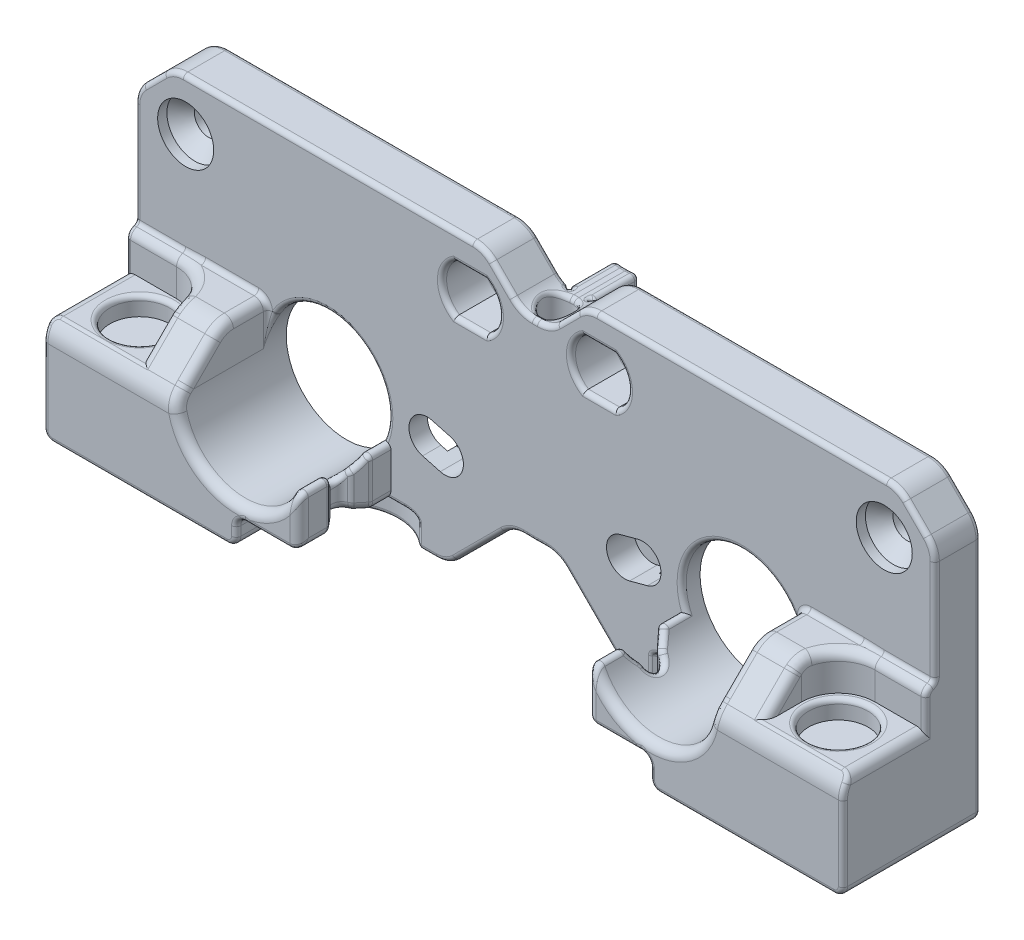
SolidWorks part; units mm, degrees
ref_plane "Front" through (0, 0, 0) normal (0, 0, 1) x (1, 0, 0)
ref_plane "Top" through (0, 0, 0) normal (0, 1, 0) x (1, 0, 0)
ref_plane "Right" through (0, 0, 0) normal (1, 0, 0) x (0, 0, -1)
sketch "Sketch1" plane through (0, 0, 0) normal (0, 0, 1) x (1, 0, 0)
  line L0 (-38.02, 0) -> (38.02, 0) construction
  line L1 (38.02, 0) -> (38.02, -31) construction
  line L2 (38.02, -31) -> (-38.02, -31) construction
  line L3 (-38.02, -31) -> (-38.02, 0) construction
  line L4 (-8.7082, -2.6) -> (-5.3318, -2.6)
  line L5 (-7.02, 0) -> (-7.02, -31) construction
  line L6 (7.02, 0) -> (7.02, -31) construction
  line L7 (0, 0) -> (0, -31) construction
  line L8 (-43.52, 5.5) -> (43.52, 5.5)
  line L9 (-43.52, 5.5) -> (-43.52, -36.5)
  line L10 (-43.52, -36.5) -> (43.52, -36.5)
  line L11 (43.52, 5.5) -> (43.52, -36.5)
  line L12 (-8.7082, 2.6) -> (-5.3318, 2.6)
  line L13 (-38.02, 2.6) -> (38.02, 2.6) construction
  line L14 (-38.02, -2.6) -> (38.02, -2.6) construction
  line L15 (5.3318, -2.6) -> (8.7082, -2.6)
  line L16 (5.3318, 2.6) -> (8.7082, 2.6)
  line L17 (-38.02, 0) -> (-7.02, -31) construction
  line L18 (7.02, -31) -> (38.02, 0) construction
  circle A0 centre (-38.02, 0) radius 1.55
  arc A1 (-5.3318, -2.6) -> (-5.3318, 2.6) centre (-7.02, 0) ccw
  arc A2 (5.3318, 2.6) -> (5.3318, -2.6) centre (7.02, 0) ccw
  circle A3 centre (38.02, 0) radius 1.55
  circle A4 centre (38.02, -31) radius 1.55
  circle A5 centre (7.02, -31) radius 1.55
  circle A6 centre (-7.02, -31) radius 1.55
  circle A7 centre (-38.02, -31) radius 1.55
  arc A8 (8.7082, -2.6) -> (8.7082, 2.6) centre (7.02, 0) ccw
  arc A9 (-8.7082, 2.6) -> (-8.7082, -2.6) centre (-7.02, 0) ccw
  circle A10 centre (-22.52, -15.5) radius 6.55
  circle A11 centre (22.52, -15.5) radius 6.55
  dimension "D5" = 3.1
  dimension "D10" = 6.2
  dimension "D13" = 13.1
  dimension "D1" = 31
  dimension "D2" = 31
  dimension "D3" = 31
  dimension "D4" = 14.04
  dimension "D6" = 5.5
  dimension "D7" = 5.5
  dimension "D8" = 5.5
  dimension "D9" = 5.5
  dimension "D11" = 2.6
  dimension "D12" = 2.6
extrude "Boss-Extrude1" add sketch "Sketch1" along normal blind 15
sketch "Sketch2" plane through (0, 0, 0) normal (0, 0, 1) x (1, 0, 0)
  line L0 (-43.52, 5.5) -> (-43.52, -36.5) construction
  line L1 (-22.52, -23.4) -> (22.52, -23.4)
  line L2 (-53.52, -26.4) -> (-53.52, -46.5)
  line L3 (-53.52, -46.5) -> (53.52, -46.5)
  line L4 (53.52, -26.4) -> (53.52, -46.5)
  line L5 (-43.52, -36.5) -> (43.52, -36.5) construction
  line L6 (43.52, -36.5) -> (43.52, 5.5) construction
  line L7 (-22.52, -23.4) -> (-22.52, -26.4)
  line L8 (22.52, -23.4) -> (22.52, -26.4)
  line L9 (53.52, -26.4) -> (22.52, -26.4)
  line L10 (-22.52, -26.4) -> (-53.52, -26.4)
  circle A0 centre (-38.02, 0) radius 1.55 construction
  dimension "D1" = 23.4
  dimension "D2" = 10
  dimension "D3" = 10
  dimension "D4" = 10
  dimension "D5" = 21
  dimension "D6" = 21
  dimension "D7" = 3
extrude "Cut-Extrude2" cut sketch "Sketch2" along normal through all
sketch "Sketch14" plane through (0, -23.4, 0) normal (0, -1, 0) x (1, 0, 0)
  line L0 (22.52, 15) -> (22.52, 0) construction
  line L1 (-22.52, 0) -> (22.52, 0)
  line L2 (-22.52, 0) -> (-22.52, 5)
  line L3 (-22.52, 5) -> (22.52, 5)
  line L4 (22.52, 0) -> (22.52, 5)
  dimension "D1" = 5
extrude "Boss-Extrude4" add sketch "Sketch14" along normal up to surface (3 mm away)
sketch "Sketch3" plane through (0, 0, 15) normal (0, 0, 1) x (1, 0, 0)
  line L0 (43.52, -26.4) -> (43.52, 5.5) construction
  line L1 (-43.52, 5.5) -> (43.52, 5.5)
  line L2 (-43.52, 5.5) -> (-43.52, -11)
  line L3 (-43.52, -11) -> (43.52, -11)
  line L4 (43.52, 5.5) -> (43.52, -11)
  dimension "D1" = 16.5
extrude "Cut-Extrude3" cut sketch "Sketch3" against normal offset from surface (10 mm away) 5
sketch "Sketch5" plane through (0, 0, 5) normal (0, 0, 1) x (1, 0, 0)
  line L0 (-6.52, 6.5) -> (-1.52, 1.5)
  line L1 (1.52, 1.5) -> (6.52, 6.5)
  line L2 (0, 1.5) -> (0, 0) construction
  line L3 (-6.52, 6.5) -> (6.52, 6.5)
  line L4 (-43.52, 5.5) -> (43.52, 5.5) construction
  line L5 (-1.52, 1.5) -> (1.52, 1.5)
  dimension "D1" = 45
  dimension "D2" = 4
  dimension "D3" = 5
  dimension "D4" = 3.04
extrude "Cut-Extrude4" cut sketch "Sketch5" against normal through all and the other way through all
sketch "Sketch8" plane through (0, 0, 5) normal (0, 0, 1) x (1, 0, 0)
  line L0 (22.52, -23.4) -> (-22.52, -23.4) construction
  line L1 (-17.7605, -11) -> (17.7605, -11) construction
  line L2 (15.67, -23.4) -> (-15.67, -23.4)
  line L3 (-29.07, -11) -> (-27.2795, -11)
  line L5 (29.07, -15.5) -> (29.07, -11)
  line L6 (27.2795, -11) -> (29.07, -11)
  line L8 (-17.7605, -11) -> (17.7605, -11)
  line L9 (-29.07, -15.5) -> (-29.07, -11)
  line L10 (-15.97, -15.5) -> (-15.67, -15.5)
  line L11 (-15.67, -15.5) -> (-15.67, -23.4)
  line L12 (15.97, -15.5) -> (15.67, -15.5)
  line L13 (15.67, -15.5) -> (15.67, -23.4)
  arc A0 (-27.2795, -11) -> (-17.7605, -11) centre (-22.52, -15.5) ccw construction
  arc A1 (17.7605, -11) -> (27.2795, -11) centre (22.52, -15.5) ccw construction
  arc A2 (-15.97, -15.5) -> (-17.7605, -11) centre (-22.52, -15.5) ccw
  arc A3 (29.07, -15.5) -> (27.2795, -11) centre (22.52, -15.5) ccw
  arc A4 (17.7605, -11) -> (15.97, -15.5) centre (22.52, -15.5) ccw
  arc A5 (-27.2795, -11) -> (-29.07, -15.5) centre (-22.52, -15.5) ccw
  dimension "D1" = 0.3
  dimension "D2" = 0.3
extrude "Cut-Extrude7" cut sketch "Sketch8" along normal through all
chamfer "Chamfer1" distance 4 angle 45 2 edges at (43.52, 5.5, 2.5) (-43.52, 5.5, 2.5)
sketch "Sketch4" plane through (0, 0, 0) normal (0, 0, 1) x (1, 0, 0)
  line L0 (0, 0) -> (0, -23.4) construction
  line L1 (43.52, -23.4) -> (-43.52, -23.4) construction
  line L2 (-1.52, 1.5) -> (1.52, 1.5) construction
  line L3 (1.35, -26.4) -> (-1.35, -26.4)
  line L4 (1.35, -26.4) -> (1.35, 1.5)
  line L5 (1.35, 1.5) -> (-1.35, 1.5)
  line L6 (-1.35, -26.4) -> (-1.35, 1.5)
  line L7 (43.52, -26.4) -> (-43.52, -26.4) construction
  dimension "D1" = 2.7
extrude "Boss-Extrude2" add sketch "Sketch4" against normal blind 5
sketch "Sketch6" plane through (0, -11, 0) normal (0, 1, 0) x (1, 0, 0)
  line L5 (38.02, -5) -> (38.02, -15) construction
  line L6 (43.52, -5) -> (29.07, -5) construction
  line L8 (29.07, -15) -> (43.52, -15) construction
  line L11 (34.02, -10) -> (34.02, -17)
  line L12 (38.02, -6) -> (45.52, -6)
  line L13 (34.02, -17) -> (45.52, -17)
  line L14 (45.52, -17) -> (45.52, -6)
  line L15 (43.52, -5) -> (43.52, -15) construction
  arc A0 (38.02, -6) -> (34.02, -10) centre (38.02, -10) ccw
  dimension "D1" = 8
  dimension "D3" = 2
  dimension "D4" = 31
  dimension "D2" = 2
extrude "Cut-Extrude5" cut sketch "Sketch6" against normal blind 4
sketch "Sketch9" plane through (0, 0, 0) normal (0, 1, 0) x (1, 0, 0)
  line L2 (15.97, -15) -> (29.07, -15) construction
  line L3 (15, -8.4) -> (11, -8.4)
  line L4 (15, -8.4) -> (16.5, -8.4)
  line L5 (15, -10.6) -> (11, -10.6)
  line L6 (11, -8.4) -> (11, -10.6)
  line L7 (15, -8.4) -> (11, -10.6) construction
  line L8 (15, -10.6) -> (11, -8.4) construction
  line L9 (16.5, -10.6) -> (15, -10.6)
  line L10 (13, -9.5) -> (16.5, -9.5) construction
  arc A0 (16.5, -10.6) -> (16.5, -8.4) centre (16.5, -9.5) ccw
  point P0 (13, -9.5)
  point P12 (0, 0)
  dimension "D2" = 2.2
  dimension "D5" = 2.2
  dimension "D1" = 5.5
  dimension "D3" = 1.5
  dimension "D4" = 4
  dimension "D6" = 16.5
extrude "Cut-Extrude8" cut sketch "Sketch9" against normal through all
sketch "Sketch13" plane through (0, -15, 0) normal (0, 1, 0) x (1, 0, 0)
  circle A0 centre (38.02, -10) radius 3.25
  dimension "D1" = 6.5
extrude "Cut-Extrude12" cut sketch "Sketch13" against normal blind 2
sketch "Sketch15" plane through (0, -26.4, 0) normal (0, -1, 0) x (1, 0, 0)
  line L0 (43.52, 0) -> (1.35, 0) construction
  arc A0 (16.5, 8.4) -> (16.5, 10.6) centre (16.5, 9.5) ccw construction
  circle A1 centre (16.5, 9.5) radius 6
  dimension "D1" = 3.5
extrude "Cut-Extrude13" cut sketch "Sketch15" against normal up to surface (3 mm away)
sketch "Sketch16" plane through (0, 0, 0) normal (0, 0, -1) x (-1, 0, 0)
  circle A0 centre (-22.52, -15.5) radius 11.2
  dimension "D1" = 22.4
extrude "Cut-Extrude14" cut sketch "Sketch16" against normal blind 3
sketch "Sketch19" plane through (0, 0, 5) normal (0, 0, 1) x (1, 0, 0)
  line L0 (-22.52, -15.5) -> (22.52, -15.5) construction
  line L1 (9.7881, -16.0176) -> (11.72, -15.5) construction
  line L2 (9.2705, -14.0858) -> (11.2024, -13.5681)
  line L4 (10.3058, -17.9495) -> (12.2376, -17.4319)
  arc A0 (9.2705, -14.0858) -> (10.3058, -17.9495) centre (9.7881, -16.0176) ccw
  arc A1 (12.2376, -17.4319) -> (11.2024, -13.5681) centre (11.72, -15.5) ccw
  dimension "D1" = 4
  dimension "D2" = 10.8
  dimension "D3" = 15
  dimension "D4" = 2
extrude "Cut-Extrude19" cut sketch "Sketch19" against normal blind 3
mirror "Mirror4" about plane through (0, 0, 0) normal (1, 0, 0) of "Cut-Extrude19", "Cut-Extrude13", "Cut-Extrude12", "Cut-Extrude5", "Cut-Extrude8", "Cut-Extrude14"
fillet "Fillet35" radius 0.2 4 edges at (-25.0949, -26.4, 1.5) (-19.9451, -26.4, 1.5) (19.9451, -26.4, 1.5) (25.0949, -26.4, 1.5)
chamfer "Chamfer3" distance 1.25 angle 45 4 edges at (-15.67, -19.45, 8.4) (-15.67, -19.45, 10.6) (15.67, -19.45, 8.4) (15.67, -19.45, 10.6)
chamfer "Chamfer2" distance 5 angle 45 2 edges at (31.545, -11, 15) (-31.545, -11, 15)
fillet "Fillet9" radius 3 4 edges at (15.97, -15.5, 13.2264) (15.97, -15.5, 6.2736) (-15.97, -15.5, 13.2264) (-15.97, -15.5, 6.2736)
fillet "Fillet10" radius 0.5 4 edges at (15.67, -15.5, 13.4061) (15.67, -15.5, 6.0939) (-15.67, -15.5, 6.0939) (-15.67, -15.5, 13.4061)
fillet "Fillet11" radius 1 4 edges at (16.6966, -20.9492, 10.5823) (16.6966, -20.9492, 8.4177) (-16.6966, -20.9492, 8.4177) (-16.6966, -20.9492, 10.5823)
fillet "Fillet12" radius 0.5 18 edges at (15.67, -20.9813, 11.8122) (15.9669, -18.1058, 11.4565) (16.5448, -18.2317, 10.767) (17.5798, -19.8008, 9.7099) (16.5878, -18.2881, 8.276) (15.67, -20.9813, 7.1878) (15.9669, -18.1058, 7.5435) (-15.67, -20.9813, 11.8122) (-15.9669, -18.1058, 11.4565) (-16.5878, -18.2881, 10.724) (-15.67, -20.9813, 7.1878) (-15.9669, -18.1058, 7.5435) (-16.5448, -18.2317, 8.233) (-17.5998, -19.8237, 9.5185)
sketch "Sketch10" plane through (0, 1.5, 0) normal (0, 1, 0) x (1, 0, 0)
  line L0 (0, -5) -> (0, -2.57) construction
  line L1 (-1.52, -5) -> (1.52, -5) construction
  line L2 (-1.52, 0) -> (-1.52, -5) construction
  circle A0 centre (0, -2.57) radius 1.6
  circle A1 centre (-1.35, 0) radius 0.17
  circle A2 centre (1.35, 0) radius 0.17
  dimension "D2" = 3.2
  dimension "D1" = 2.43
extrude "Cut-Extrude9" cut sketch "Sketch10" against normal through all and the other way through all
fillet "Fillet32" radius 3 4 edges at (31.545, -11, 10) (36.2854, -16, 15) (-36.2854, -16, 15) (-31.545, -11, 10)
fillet "Fillet13" radius 0.5 4 edges at (1.52, -12.45, 0) (1.35, -12.45, -0.17) (-1.35, -12.45, -0.17) (-1.52, -12.45, 0)
fillet "Fillet14" radius 1 52 edges at (15.67, -23.4, 6.0033) (15.6999, -23.4, 7.177) (16.1456, -23.4, 7.7576) (16.6867, -23.4, 8.3577) (17.6, -23.4, 9.5) (16.6867, -23.4, 10.6423) (16.1456, -23.4, 11.2424) (15.6999, -23.4, 11.823) (-15.67, -23.4, 6.0033) (-15.6999, -23.4, 7.177) (-16.1456, -23.4, 7.7576) (-16.6867, -23.4, 8.3577) (-17.6, -23.4, 9.5) (-16.6867, -23.4, 10.6423) (-16.1456, -23.4, 11.2424) (-15.6999, -23.4, 11.823) (-43.52, -26.4, 7.5) (43.52, -26.4, 7.5) (15.67, -23.4, 13.4967) (-15.67, -23.4, 13.4967) (-22.52, -26.4, 10) (22.52, -26.4, 10) (22.52, -23.4, 10) (-22.52, -23.4, 10) (15.67, -20.9813, 15) (16.0586, -18.0752, 15) (23.109, -22.0235, 15) (29.017, -16.3315, 14.8583) (29.07, -11, 6.8787) (29.07, -11.2284, 9.9054) (40.77, -11, 6) (35.6717, -11, 6.7619) (34.044, -11.1102, 9.5629) (-29.07, -11, 6.8787) (-29.07, -11.2284, 9.9054) (-15.67, -20.9813, 15) (-16.0586, -18.0752, 15) (-23.109, -22.0235, 15) (-29.016, -16.3396, 14.8609) (-40.77, -11, 6) (-35.6717, -11, 6.7619) (-34.0995, -11.0338, 9.2066) (43.52, -15, 10) (-43.52, -15, 10) (29.07, -13.5, 12.5) (34.02, -13.4393, 12.4393) (-29.07, -13.5, 12.5) (-34.02, -13.4393, 12.4393) (29.07, -15.304, 14.2895) (-29.07, -15.304, 14.2895) (34.02, -11.5346, 10.4667) (-34.02, -11.5346, 10.4667)
sketch "Sketch18" plane through (0, 0, 5) normal (0, 0, 1) x (1, 0, 0)
  line L0 (0, 0) -> (0, -26.4) construction
  line L1 (12.5314, -26.4) -> (-12.5314, -26.4) construction
  line L2 (-2.5, -19.4) -> (2.5, -19.4)
  line L3 (2.5, -19.4) -> (11.5, -28.4)
  line L4 (-2.5, -19.4) -> (-11.5, -28.4)
  line L5 (-11.5, -28.4) -> (11.5, -28.4)
  point P8 (0, -19.4)
  dimension "D1" = 45
  dimension "D2" = 2
  dimension "D3" = 7
  dimension "D4" = 5
extrude "Cut-Extrude15" cut sketch "Sketch18" against normal through all
fillet "Fillet21" radius 3 31 edges at (-1.6179, -19.4, 0.0328) (-9.5, -26.4, 2.5) (9.5, -26.4, 2.5) (2.148, -19.4, 0) (-2.148, -19.4, 0) (-2.5, -19.4, 2.5) (1.6179, -19.4, 0.0328) (2.5, -19.4, 2.5) (5.52, 5.5, 2.5) (-5.52, 5.5, 2.5) (39.52, 5.5, 2.5) (43.52, 1.5, 2.5) (-43.52, 1.5, 2.5) (-39.52, 5.5, 2.5) (1.52, 1.5, 4.0348) (-1.52, 1.5, 4.0348) (1.6, 1.58, 2.57) (-1.6, 1.58, 2.57) (1.52, 1.5, 1.0767) (1.6519, 1.6319, 0.0212) (1.2298, 1.5, 0.1202) (-1.2298, 1.5, 0.1202) (-1.52, 1.5, 1.0767) (-1.4908, 1.5, 0.1039) (-1.3172, 1.5, -0.2679) (1.3172, 1.5, -0.2679) (1.4908, 1.5, 0.1039) (-1.6519, 1.6319, 0.0212)
fillet "Fillet22" radius 0.5 68 edges at (1.35, -8.8508, -5) (0, -19.4, -5) (-1.1815, -19.4, 0.0226) (-1.3172, -19.4, -0.2679) (-1.35, -19.4, -2.723) (1.35, -19.4, -2.723) (1.3172, -19.4, -0.2679) (6, -22.9, 0) (3.52, 3.5, 0) (22.52, 5.5, 0) (41.52, 3.5, 0) (5.6146, 5.2716, 0) (39.4254, 5.2716, 0) (43.2916, 1.4054, 0) (9.5946, -26.1716, 0) (1.1815, -19.4, 0.0226) (-6, -22.9, 0) (-43.52, -12.5713, 0) (-41.52, 3.5, 0) (-22.52, 5.5, 0) (-3.52, 3.5, 0) (-43.2916, 1.4054, 0) (-39.4254, 5.2716, 0) (-5.6146, 5.2716, 0) (-9.5946, -26.1716, 0) (0, 1.5, -5) (2.6506, -19.7431, 0) (1.6321, -19.4235, 0.0276) (1.359, -19.4017, 0.1698) (-1.3665, -19.402, 0.1692) (-1.6041, -19.4201, 0.0383) (-2.6506, -19.7431, 0) (0.8228, 1.55, -5) (1.35, 1.6983, -2.723) (1.3243, 1.6886, -0.2876) (1.207, 1.6477, 0.092) (1.61, 1.8122, 0.0359) (2.1122, 2.1265, 0) (-2.1122, 2.1265, 0) (-1.6197, 1.8171, 0.0321) (-1.2394, 1.6584, 0.1291) (-1.3105, 1.6835, -0.2513) (-1.35, 1.6983, -2.723) (-0.8228, 1.55, -5) (-36.47, 0, 0) (39.57, 0, 0) (-1.35, -8.8508, -5) (-10.12, 0, 0) (-7.02, -2.6, 0) (-3.92, 0, 0) (-7.02, 2.6, 0) (-22.52, -4.3, 0) (-18.7837, -26.235, 0) (-26.2563, -26.235, 0) (22.52, -4.3, 0) (26.2563, -26.235, 0) (18.7837, -26.235, 0) (10.12, 0, 0) (7.02, 2.6, 0) (3.92, 0, 0) (7.02, -2.6, 0) (43.52, -12.5713, 0) (-43.2271, -26.1071, 0) (43.2271, -26.1071, 0)
fillet "Fillet24" radius 0.5 8 edges at (29.07, -13.75, 5) (-29.07, -13.75, 5) (-29.3629, -11.2929, 5) (-40.77, -11, 5) (40.77, -11, 5) (29.3629, -11.2929, 5) (-34.045, -11, 5) (34.045, -11, 5)
fillet "Fillet26" radius 0.5 57 edges at (-28.8823, -13.9431, 5.1095) (28.8823, -13.9431, 5.1095) (-19.8412, -9.5228, 5) (19.8412, -9.5228, 5) (10.12, 0, 5) (7.02, 2.6, 5) (3.92, 0, 5) (7.02, -2.6, 5) (-7.02, -2.6, 5) (-3.92, 0, 5) (-7.02, 2.6, 5) (-10.12, 0, 5) (-15.9629, -23.1071, 14.7071) (-19.095, -23.4, 15) (-22.2271, -23.6929, 15) (-22.52, -24.9, 15) (-22.8129, -26.1071, 15) (-33.02, -26.4, 15) (-43.2271, -26.1071, 15) (-43.52, -21.3213, 15) (-43.52, -16.6069, 14.9319) (15.9629, -23.1071, 14.7071) (19.095, -23.4, 15) (22.2271, -23.6929, 15) (22.52, -24.9, 15) (22.8129, -26.1071, 15) (33.02, -26.4, 15) (43.2271, -26.1071, 15) (43.52, -21.3213, 15) (43.52, -16.6069, 14.9319) (43.52, -14, 6) (43.52, -11.4226, 5.8165) (43.52, -10.8745, 5.0918) (43.52, -5.1642, 5) (43.2916, 1.4054, 5) (41.52, 3.5, 5) (39.4254, 5.2716, 5) (22.52, 5.5, 5) (5.6146, 5.2716, 5) (3.52, 3.5, 5) (1.4254, 1.7284, 5) (0, 1.5, 5) (-1.4254, 1.7284, 5) (-3.52, 3.5, 5) (-5.6146, 5.2716, 5) (-22.52, 5.5, 5) (-39.4254, 5.2716, 5) (-41.52, 3.5, 5) (-43.2916, 1.4054, 5) (-43.52, -5.1642, 5) (-43.52, -10.8745, 5.0918) (-43.52, -11.4226, 5.8165) (-37.77, -15, 14) (37.77, -15, 14) (-43.52, -14, 6) (-43.2841, -15.3549, 14.3316) (43.4527, -15.6394, 14.5357)
sketch "Sketch11" plane through (0, 0, 5) normal (0, 0, 1) x (1, 0, 0)
  circle A0 centre (-38.02, 0) radius 3.05
  circle A1 centre (38.02, 0) radius 3.05
  dimension "D1" = 6.1
extrude "Cut-Extrude10" cut sketch "Sketch11" against normal blind 1
chamfer "Chamfer4" distance 1.5 angle 45 2 edges at (-36.47, 0, 4) (39.57, 0, 4)
fillet "Fillet31" radius 0.5 8 edges at (-1.5944, 1.8046, 2.4364) (0, 1.5, 4.17) (0, 1.5, 0.97) (1.5944, 1.8046, 2.7036) (1.6, -19.4, 2.57) (0, -19.4, 0.97) (0, -19.4, 4.17) (-1.6, -19.4, 2.57)
fillet "Fillet33" radius 0.5 2 edges at (38.02, -15, 13.25) (-38.02, -15, 13.25)
fillet "Fillet36" radius 0.5 29 edges at (6, -22.9, 5) (-11.637, -26.4, 5) (-6, -22.9, 5) (0, -19.4, 5) (-9.5946, -26.1716, 5) (9.5946, -26.1716, 5) (2.4054, -19.6284, 5) (-2.4054, -19.6284, 5) (21.9943, -26.4, 5) (11.637, -26.4, 5) (12.5314, -24.9, 5) (20.4686, -24.9, 5) (16.5, -26.4, 3.5) (16.5, -23.4, 3.5) (14.6007, -23.4, 5) (-21.9943, -26.4, 5) (-20.9943, -23.4, 5) (-12.5314, -24.9, 5) (-20.4686, -24.9, 5) (-16.5, -26.4, 3.5) (-16.5, -23.4, 3.5) (-14.6007, -23.4, 5) (20.9943, -23.4, 5) (-22.52, -24.9, 5) (22.52, -24.9, 5) (22.2271, -23.6929, 5) (-22.2271, -23.6929, 5) (-22.8129, -26.1071, 5) (22.8129, -26.1071, 5)
